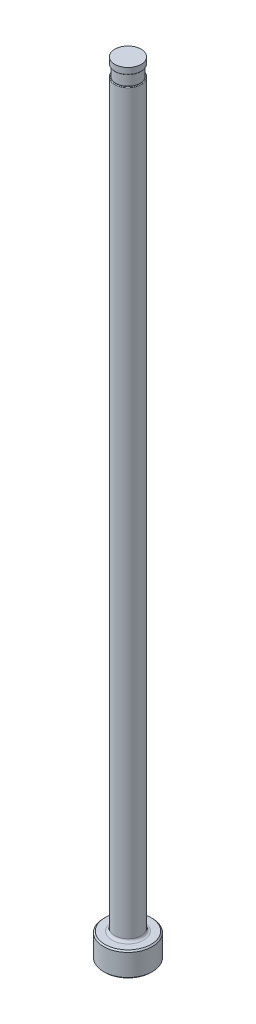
SolidWorks part; units mm, degrees
ref_plane "Front Plane" through (0, 0, 0) normal (0, 0, 1) x (1, 0, 0)
ref_plane "Top Plane" through (0, 0, 0) normal (0, 1, 0) x (1, 0, 0)
ref_plane "Right Plane" through (0, 0, 0) normal (1, 0, 0) x (0, 0, -1)
other "Configuration Table"
sketch "Sketch1" plane through (0, 0, 0) normal (0, 0, 1) x (1, 0, 0)
  line L0 (0, 259.9588) -> (0, -15.1925) construction
  line L1 (0, 0) -> (-4.7625, 0)
  line L2 (-4.7625, 0) -> (-4.7625, 4.7498)
  line L3 (-4.7625, 4.7498) -> (-2.5794, 4.7498)
  line L4 (-2.5794, 4.7498) -> (-2.5794, 152.4)
  line L5 (-2.5794, 152.4) -> (0, 152.4)
  line L6 (0, 152.4) -> (0, 0)
  dimension "L" = 152.4
  dimension "H" = 9.525
  dimension "T" = 4.7498
  dimension "D" = 5.1587
revolve "Revolve1" add sketch "Sketch1" angle 360 about L0
chamfer "Chamfer1" distance 0.254 angle 45 2 edges at (0, 4.7498, 4.7625) (0, 0, 4.7625)
fillet "Fillet1" radius 0.508 1 edges at (0, 4.7498, 2.5794)
sketch "Sketch2" plane through (0, 0, 0) normal (0, 0, 1) x (1, 0, 0)
  line L0 (-2.5794, 152.4) -> (-2.5794, 5.2578) construction
  line L1 (-2.5794, 151.13) -> (-2.3762, 151.13)
  line L2 (-2.5794, 151.13) -> (-2.5794, 149.098)
  line L3 (-2.5794, 149.098) -> (-2.3762, 149.098)
  line L4 (-2.3762, 151.13) -> (-2.3762, 149.098)
  line L5 (2.5794, 152.4) -> (-2.5794, 152.4) construction
  line L6 (0, 153.4483) -> (0, 147.3282) construction
  dimension "D1" = 2.032
  dimension "N" = 1.27
  dimension "FD" = 0.2032
  dimension "D3" = 4.7523
revolve "Vent Relief" cut sketch "Sketch2" angle 360 about L6
sketch "Sketch3" plane through (0, 0, 0) normal (0, 0, 1) x (1, 0, 0)
  line L0 (-2.3762, 150.114) -> (-2.3762, 86.614)
  line L1 (-2.3762, 151.13) -> (-2.3762, 149.098) construction
  line L2 (-2.5794, 149.098) -> (-2.5794, 5.2578) construction
  line L3 (-2.5794, 85.4964) -> (-2.5794, 150.114)
  line L4 (-2.5794, 150.114) -> (-2.3762, 150.114)
  arc A0 (-2.3762, 86.614) -> (-2.5794, 85.4964) centre (-5.5512, 86.614) cw
  dimension "D1" = 3.175
  dimension "D2" = 63.5
extrude "D-Slot" cut sketch "Sketch3" against normal through all both and the other way through all
sketch "Sketch5" plane through (0, 0, 0) normal (0, 0, 1) x (1, 0, 0)
  line L0 (-2.5794, 151.13) -> (2.5794, 151.13) construction
  line L1 (-2.5794, 152.4) -> (-2.5667, 152.4)
  line L2 (-2.5794, 152.4) -> (-2.5794, 151.13)
  line L3 (-2.5794, 151.13) -> (-2.5667, 151.13)
  line L4 (-2.5667, 152.4) -> (-2.5667, 151.13)
  line L5 (0, 152.6877) -> (0, 150.5771) construction
  dimension "VP" = 0.0127
revolve "Vent Diameter" cut sketch "Sketch5" angle 360 about L5
fillet "Fillet2" radius 0.127 2 edges at (2.5794, 149.098, 0) (0, 151.13, 2.5667)
sketch "Pocket Sketch" plane through (0, 0, 0) normal (0, 0, 1) x (1, 0, 0)
  line L0 (-5.1594, 0) -> (-5.1594, 4.7752)
  line L1 (-5.1594, 4.7752) -> (-3.5398, 4.7752)
  line L2 (-2.7778, 5.5372) -> (-2.7778, 22.225)
  line L3 (-2.7778, 22.225) -> (0, 22.225)
  line L4 (0, 22.225) -> (0, 0)
  line L5 (0, 0) -> (-5.1594, 0)
  line L6 (0, 12.6104) -> (0, -2.4989) construction
  line L7 (-4.7625, 4.4958) -> (-4.7625, 0.254) construction
  line L8 (4.5085, 4.7498) -> (-4.5085, 4.7498) construction
  line L9 (-2.5794, 85.4964) -> (-2.5794, 5.2578) construction
  line L10 (-3.5398, 4.7752) -> (-2.7778, 5.5372)
  point P3 (-2.7778, 4.7752)
  dimension "D1" = 10.3187
  dimension "D2" = 0.3969
  dimension "D3" = 0.0254
  dimension "D4" = 0.1984
  dimension "D5" = 5.5556
  dimension "D6" = 22.225
